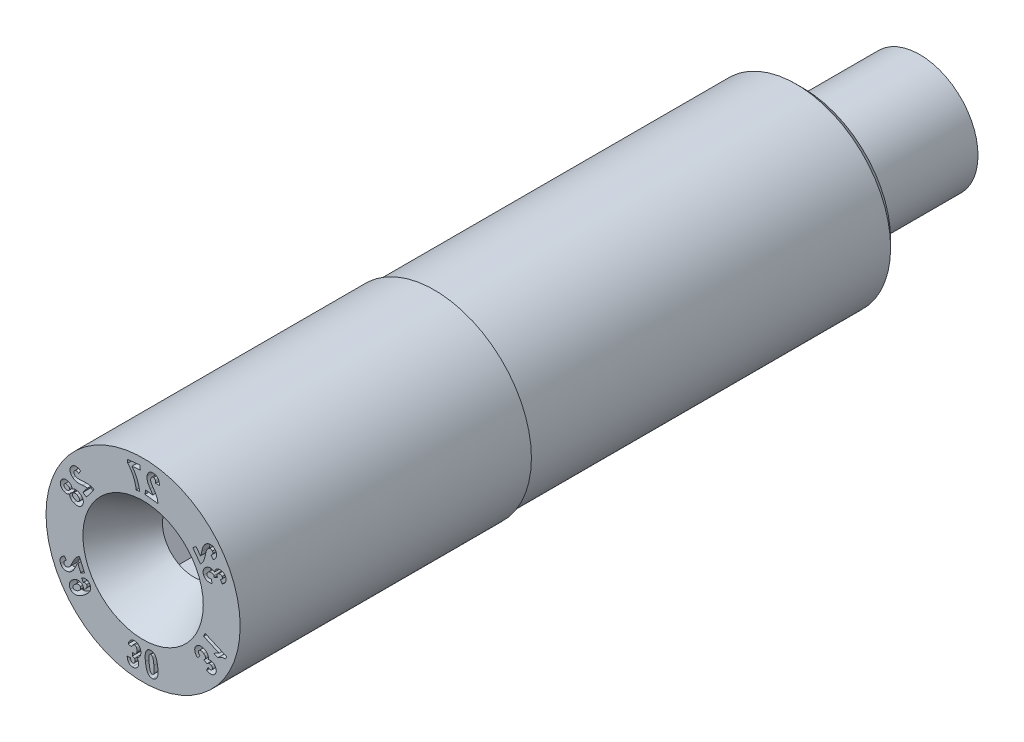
SolidWorks part; units mm, degrees
other "<M3L6-SetScrew>-<Chamfer1>"
ref_plane "Front Plane" through (0, 0, 0) normal (0, 0, 1) x (1, 0, 0)
ref_plane "Top Plane" through (0, 0, 0) normal (0, 1, 0) x (1, 0, 0)
ref_plane "Right Plane" through (0, 0, 0) normal (1, 0, 0) x (0, 0, -1)
sketch "Sketch1" plane through (0, 0, 0) normal (1, 0, 0) x (0, 0, -1)
  line L0 (1.299, 0.8) -> (0, 1.55)
  line L2 (0, 2.5) -> (0, 1.55)
  line L3 (16.75, 2.5) -> (0, 2.5)
  line L4 (-3.7979, 0) -> (49996.2021, 0) construction
  line L8 (14, 0.8) -> (1.299, 0.8)
  line L12 (17, 1.5) -> (17, 2.25)
  line L16 (17, 2.25) -> (16.75, 2.5)
  line L17 (17, 1.5) -> (14, 1.5)
  line L18 (14, 0.8) -> (14, 1.5)
  dimension "D1" = 17
  dimension "D2" = 45
  dimension "D3" = 0.25
  dimension "D4" = 5
  dimension "D5" = 30
  dimension "D6" = 1.55
  dimension "D7" = 1.6
  dimension "D8" = 3
  dimension "D9" = 3
revolve "Revolve1" add sketch "Sketch1" angle 360 about L4
sketch "Sketch5" plane through (0, 0, 0) normal (1, 0, 0) x (0, 0, -1)
  line L0 (0, 0) -> (50000, 0) construction
  line L1 (0, 2.5) -> (0, -2.5) construction
  line L2 (7.5, 2.435) -> (17, 2.435)
  line L3 (7.5, 2.435) -> (7.5, 3.435)
  line L4 (7.5, 3.435) -> (17, 3.435)
  line L5 (17, 2.435) -> (17, 3.435)
  line L6 (17, -2.25) -> (17, 2.25) construction
  line L7 (16.75, 2.5) -> (0, 2.5) construction
  dimension "D1" = 7.5
  dimension "D2" = 0.065
  dimension "D3" = 1
revolve "Cut-Revolve1" cut sketch "Sketch5" angle 360 about L0
sketch "Sketch2" plane through (0, 0, 0) normal (0, 0, 1) x (1, 0, 0)
  line L0 (0, 0) -> (0, 2.5) construction
  line L1 (0, 0) -> (2.1651, 1.25) construction
  line L2 (0, 0) -> (2.1651, -1.25) construction
  line L3 (0, 0) -> (0, -2.5) construction
  line L4 (0, 0) -> (-2.1651, -1.25) construction
  line L5 (0, 0) -> (-2.1651, 1.25) construction
  arc A0 (0.3956, 1.6726) -> (0.8362, 1.5016) centre (0, 0) ccw construction
  circle A1 centre (0, 0) radius 2.5 construction
  text T0 "27     28     29     30     31     32" font "Arial Narrow" height 0.6
  point P17 (0, 0)
  point P21 (0, 0)
  dimension "D1" = 3.4375
  dimension "D2" = 6
extrude "Cut-Extrude1" cut sketch "Sketch2" against normal blind 0.2
ref_plane "Plane1" through (0, 0, -1.299) normal (0, 0, 1) x (1, 0, 0)
sketch "Sketch6" plane through (0, 0, -1.299) normal (0, 0, 1) x (1, 0, 0)
  line L1 (0.9238, 0) -> (0.4619, 0.8)
  line L2 (0.4619, 0.8) -> (-0.4619, 0.8)
  line L3 (-0.4619, 0.8) -> (-0.9238, 0)
  line L4 (-0.9238, 0) -> (-0.4619, -0.8)
  line L5 (-0.4619, -0.8) -> (0.4619, -0.8)
  line L6 (0.4619, -0.8) -> (0.9238, 0)
  circle A0 centre (0, 0) radius 0.8 construction
  circle A1 centre (0, 0) radius 0.8 construction
  point P11 (0, 0.8)
extrude "Cut-Extrude2" cut sketch "Sketch6" against normal blind 1.6
inserted part "M3L6-SetScrew"
move or copy body "Body-Move/Copy2" placed by mates yes
other "Distance1" parameters "D1"=3
